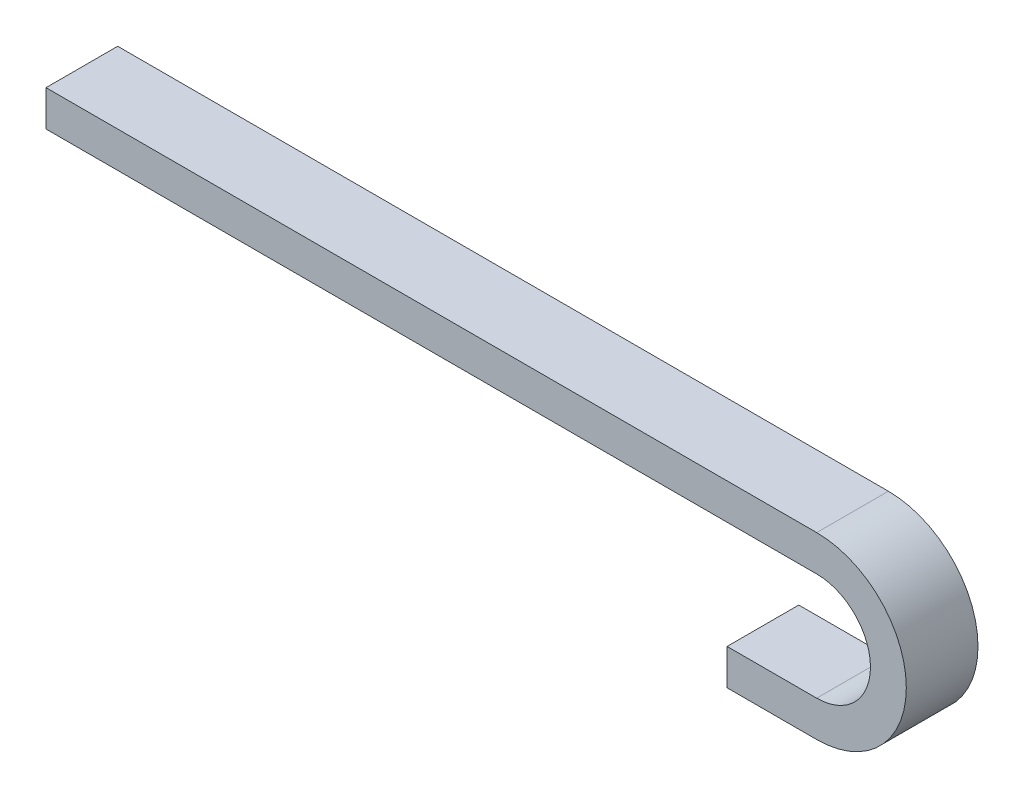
SolidWorks part; units mm, degrees
ref_plane "Ebene vorne" through (0, 0, 0) normal (0, 0, 1) x (1, 0, 0)
ref_plane "Ebene oben" through (0, 0, 0) normal (0, 1, 0) x (1, 0, 0)
ref_plane "Ebene rechts" through (0, 0, 0) normal (1, 0, 0) x (0, 0, -1)
sketch "Steuerskizze" plane through (0, 0, 0) normal (0, 0, 1) x (1, 0, 0)
  line L0 (0, 0) -> (125, 0)
  line L1 (125, 200) -> (-950, 200)
  line L2 (-1050, 200) -> (-1050, 0) construction
  line L3 (-1050, 0) -> (0, 0) construction
  line L4 (-950, 200) -> (-1050, 200) construction
  arc A0 (125, 0) -> (125, 200) centre (125, 100) ccw
  dimension "D1" = 1050
  dimension "Radius" = 100
  dimension "D2" = 100
  dimension "D3" = 1075
sketch "Skizze1" plane through (0, 0, 0) normal (0, 0, 1) x (1, 0, 0)
  line L0 (125, 200) -> (-950, 200) construction
  line L1 (0, 0) -> (125, 0) construction
  line L2 (125, 200) -> (-950, 200)
  line L3 (0, 0) -> (125, 0)
  arc A0 (125, 0) -> (125, 200) centre (125, 100) ccw construction
  arc A1 (125, 0) -> (125, 200) centre (125, 100) ccw
extrude "Linear-Austragen-Dünn1" add sketch "Skizze1" along normal mid plane 100 thin
equation "\"D3@Steuerskizze\" = 1100-((\"D2@Steuerskizze\"-50)/2)"
